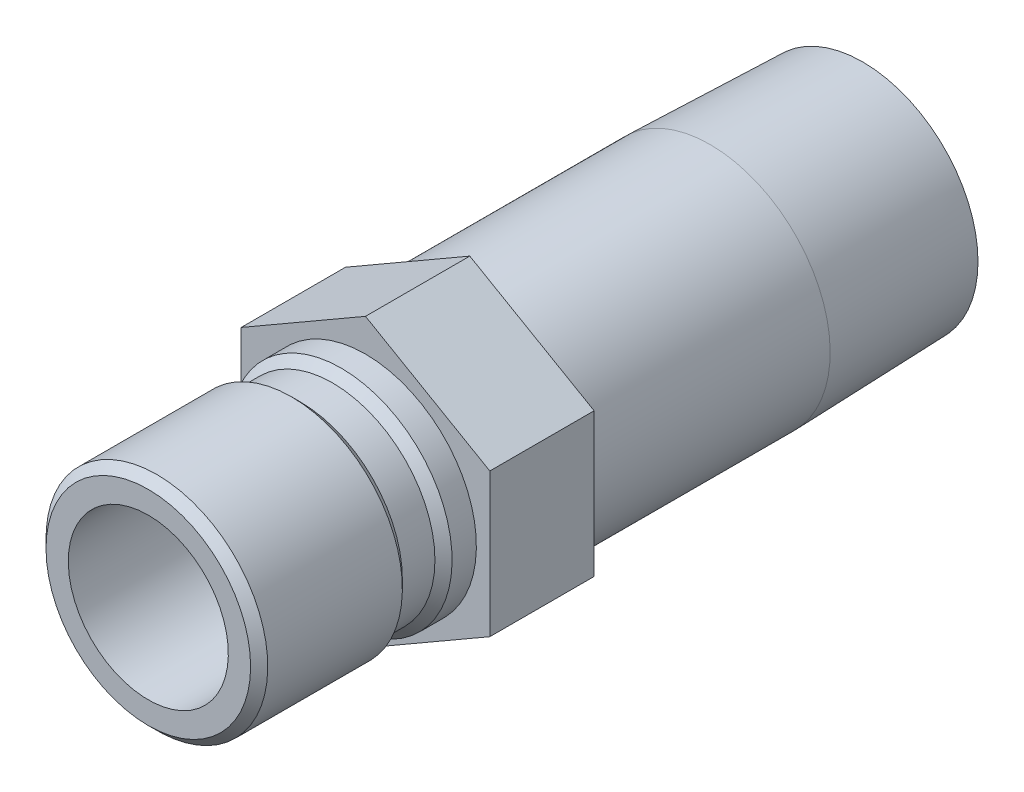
SolidWorks part; units mm, degrees
ref_plane "Front Plane" through (0, 0, 0) normal (0, 0, 1) x (1, 0, 0)
ref_plane "Top Plane" through (0, 0, 0) normal (0, 1, 0) x (1, 0, 0)
ref_plane "Right Plane" through (0, 0, 0) normal (1, 0, 0) x (0, 0, -1)
sketch "Sketch1" plane through (0, 0, 0) normal (1, 0, 0) x (0, 0, -1)
  line L0 (0, 0) -> (-22.479, 0) construction
  line L1 (-19.304, 7.112) -> (-19.304, 9.0932)
  line L2 (-5.8166, 9.0932) -> (-5.8166, 0) construction
  line L3 (-18.542, 9.8552) -> (-6.5786, 9.8552)
  line L4 (0, 10.668) -> (0, 0) construction
  line L5 (-5.8166, 9.0932) -> (-2.921, 9.0932)
  line L6 (-2.159, 9.8552) -> (0, 9.8552)
  line L7 (0, 9.8552) -> (0, 10.668)
  line L8 (-5.8166, 9.0932) -> (-6.5786, 9.8552)
  line L9 (-2.921, 9.0932) -> (-2.159, 9.8552)
  line L10 (-19.304, 9.0932) -> (-18.542, 9.8552)
  line L11 (-19.304, 7.112) -> (-1.524, 7.112)
  line L12 (0, 10.668) -> (30.6324, 10.668)
  line L13 (30.6324, 10.668) -> (44.196, 10.2441)
  line L14 (44.196, 10.2441) -> (44.196, 7.8994)
  line L15 (0, 9.8552) -> (9.271, 9.8552) construction
  line L16 (9.271, 9.8552) -> (9.271, 0) construction
  line L17 (9.271, 0) -> (0, 0) construction
  line L18 (-1.524, 7.112) -> (-1.1053, 7.8994)
  line L19 (-1.1053, 7.8994) -> (44.196, 7.8994)
  dimension "D1" = 19.304
  dimension "D2" = 2.8956
  dimension "D3" = 0.762
  dimension "D4" = 45
  dimension "D5" = 13.4874
  dimension "D6" = 45
  dimension "D7" = 1.79
  dimension "D8" = 13.5636
  dimension "D9" = 63.5
  dimension "D10" = 3.175
  dimension "D11" = 28.575
  dimension "D12" = 14.224
  dimension "D13" = 21.336
  dimension "D14" = 19.7104
  dimension "D15" = 15.7988
  dimension "D16" = 118
  dimension "D17" = 17.78
revolve "Revolve1" add sketch "Sketch1" angle 360 about L0
sketch "Sketch2" plane through (0, 0, 0) normal (0, 0, 1) x (1, 0, 0)
  line L1 (-11.049, 6.3791) -> (-11.049, -6.3791)
  line L2 (-11.049, -6.3791) -> (0, -12.7583)
  line L3 (0, -12.7583) -> (11.049, -6.3791)
  line L4 (11.049, -6.3791) -> (11.049, 6.3791)
  line L5 (11.049, 6.3791) -> (0, 12.7583)
  line L6 (0, 12.7583) -> (-11.049, 6.3791)
  circle A0 centre (0, 0) radius 11.049 construction
  circle A1 centre (0, 0) radius 7.112 construction
  circle A2 centre (0, 0) radius 7.112
  dimension "D1" = 22.098
extrude "Boss-Extrude1" add sketch "Sketch2" against normal up to vertex (9.271 mm away) from vertex at 0
